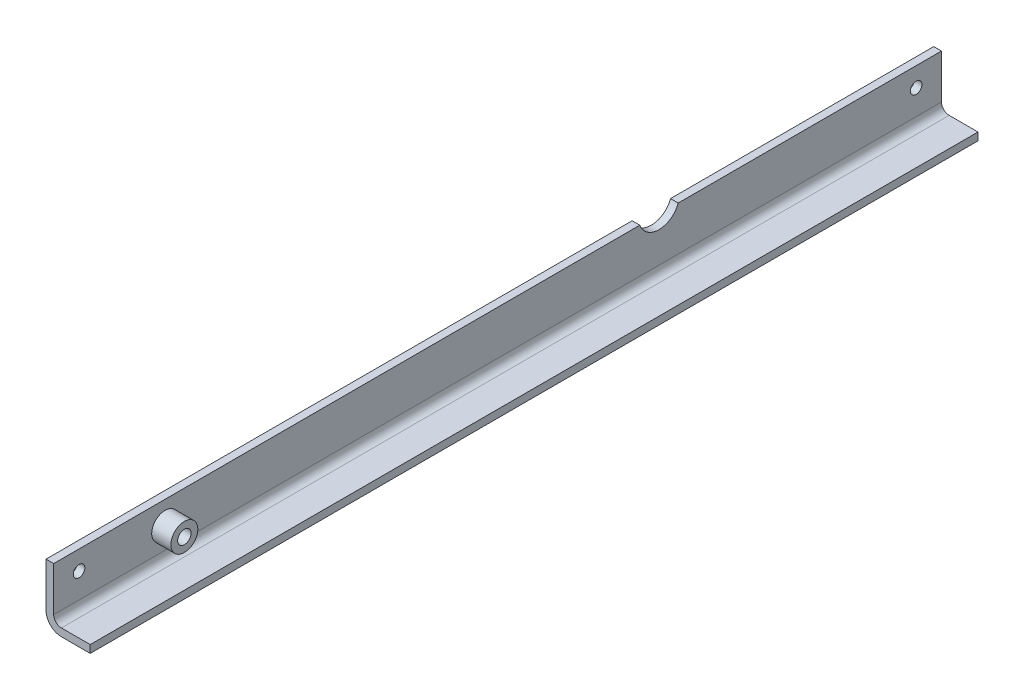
SolidWorks part; units mm, degrees
ref_plane "Спереди" through (0, 0, 0) normal (0, 0, 1) x (1, 0, 0)
ref_plane "Сверху" through (0, 0, 0) normal (0, 1, 0) x (1, 0, 0)
ref_plane "Справа" through (0, 0, 0) normal (1, 0, 0) x (0, 0, -1)
sketch "Эскиз1" plane through (0, 0, 0) normal (0, 0, 1) x (1, 0, 0)
  line L0 (8, 4) -> (23, 4)
  line L1 (8, 0) -> (23, 0)
  line L2 (0, 8) -> (0, 31)
  line L3 (0, 31) -> (23, 31) construction
  line L4 (23, 0) -> (23, 31) construction
  line L5 (4, 8) -> (4, 31)
  line L6 (4, 4) -> (4, 31) construction
  line L7 (4, 4) -> (23, 4) construction
  line L8 (0, 0) -> (23, 0) construction
  line L9 (0, 0) -> (0, 31) construction
  line L10 (0, 31) -> (4, 31)
  line L11 (23, 4) -> (23, 0)
  arc A0 (4, 8) -> (8, 4) centre (8, 8) ccw
  arc A1 (8, 0) -> (0, 8) centre (8, 8) cw
  point P14 (0, 0)
  dimension "D4" = 4
  dimension "D5" = 8
  dimension "D1" = 23
  dimension "D2" = 31
  dimension "D3" = 4
extrude "Бобышка-Вытянуть1" add sketch "Эскиз1" along normal blind 462
sketch "Эскиз2" plane through (4, 0, 0) normal (1, 0, 0) x (0, 0, -1)
  line L0 (-462, 21) -> (0, 21) construction
  line L1 (-462, 8) -> (-462, 31) construction
  line L2 (0, 8) -> (0, 31) construction
  line L3 (-462, 31) -> (0, 31) construction
  line L4 (-375.5141, 24) -> (-254.4859, 24) construction
  line L5 (-315, 24) -> (-315, 49.0124) construction
  line L6 (-325, 31) -> (-305, 31)
  circle A0 centre (-448.8, 21) radius 3
  circle A1 centre (-13.2, 21) radius 3
  circle A2 centre (-58, 19) radius 3.5
  arc A3 (-305, 31) -> (-325, 31) centre (-315, 34.6429) cw
  dimension "D4" = 6
  dimension "D5" = 6
  dimension "D8" = 7
  dimension "D11" = 10.6429
  dimension "D1" = 13.2
  dimension "D2" = 13.2
  dimension "D3" = 10
  dimension "D6" = 12
  dimension "D7" = 58
  dimension "D9" = 7
  dimension "D10" = 20
  dimension "D12" = 147
extrude "Вырез-Вытянуть1" cut sketch "Эскиз2" against normal through all
sketch "Эскиз3" plane through (4, 0, 0) normal (1, 0, 0) x (0, 0, -1)
  circle A0 centre (-58, 19) radius 3.5
  circle A1 centre (-58, 19) radius 3.5 construction
  circle A2 centre (-58, 19) radius 7
  dimension "D1" = 3.5
extrude "Бобышка-Вытянуть2" add sketch "Эскиз3" along normal blind 10
move or copy body "Тело-Переместить/Копировать2" bodies to move or copy 105
move or copy body "Тело-Переместить/Копировать1" [suppressed] bodies to move or copy 105
